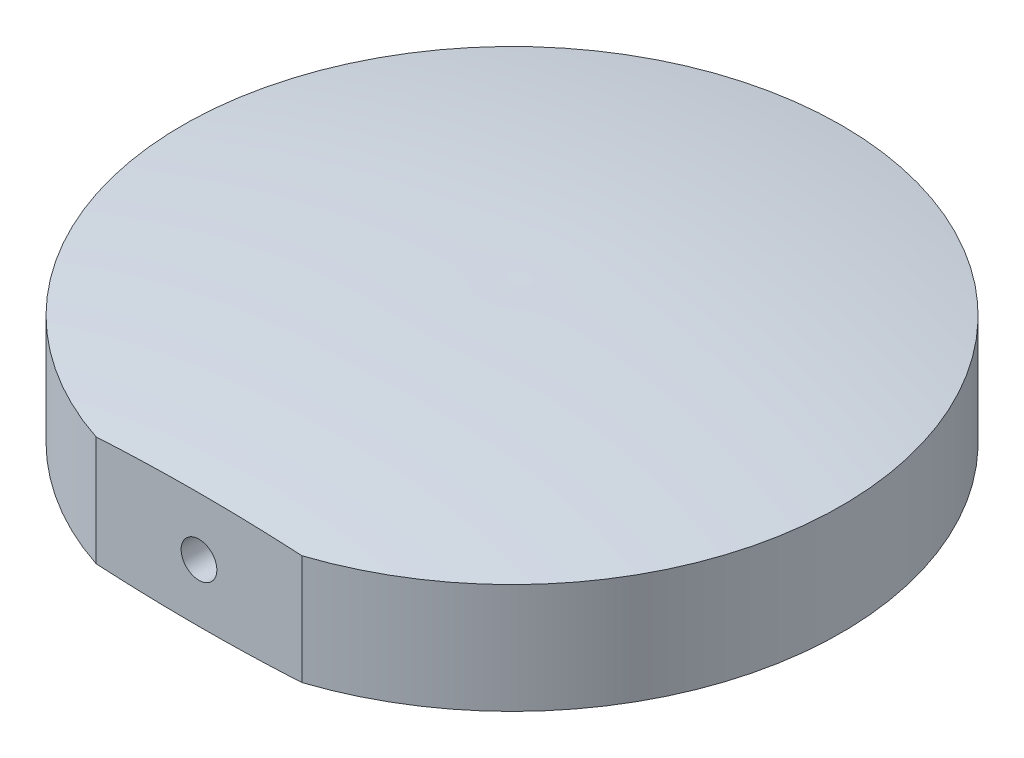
SolidWorks part; units mm, degrees
ref_plane "Front Plane" through (0, 0, 0) normal (0, 0, 1) x (1, 0, 0)
ref_plane "Top Plane" through (0, 0, 0) normal (0, 1, 0) x (1, 0, 0)
ref_plane "Right Plane" through (0, 0, 0) normal (1, 0, 0) x (0, 0, -1)
sketch "Sketch1" plane through (0, 0, 0) normal (0, 0, 1) x (1, 0, 0)
  line L0 (0, -15) -> (0, 15)
  line L1 (60, -10) -> (60, 10)
  arc A0 (0, 15) -> (60, 10) centre (4.1256, -297.993) cw
  arc A1 (0, -15) -> (60, -10) centre (4.1256, 297.993) ccw
  point P4 (0, 0)
  point P8 (60, 0)
  dimension "D1" = 30
  dimension "D2" = 20
  dimension "D3" = 60
revolve "Revolve4" add sketch "Sketch1" angle 360 about L0
sketch "Sketch2" plane through (0, 0, 0) normal (0, 0, 1) x (1, 0, 0)
  circle A0 centre (0, 0) radius 3.25
  dimension "D1" = 6.5
extrude "Cut-Extrude1" cut sketch "Sketch2" against normal mid plane 153
sketch "Sketch3" plane through (0, 0, 0) normal (0, 1, 0) x (1, 0, 0)
  line L0 (-18.735, -57) -> (18.735, -57)
  circle A0 centre (0, 0) radius 60 construction
  arc A1 (-18.735, -57) -> (18.735, -57) centre (0, 0) ccw
  dimension "D1" = 57
extrude "Cut-Extrude2" cut sketch "Sketch3" against normal mid plane 153
